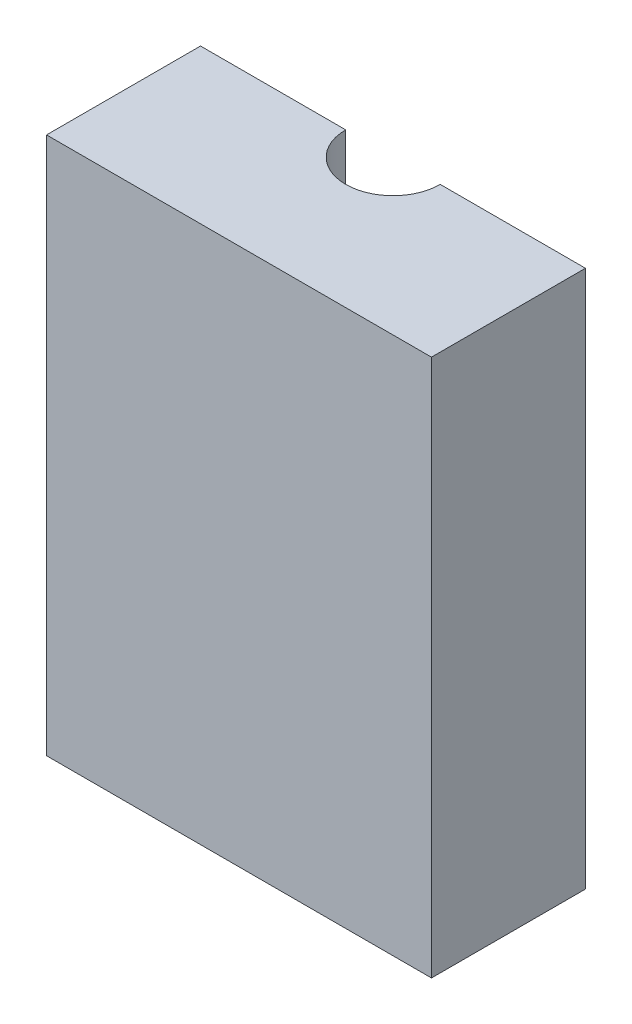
SolidWorks part; units mm, degrees
ref_plane "Front Plane" through (0, 0, 0) normal (0, 0, 1) x (1, 0, 0)
ref_plane "Top Plane" through (0, 0, 0) normal (0, 1, 0) x (1, 0, 0)
ref_plane "Right Plane" through (0, 0, 0) normal (1, 0, 0) x (0, 0, -1)
imported_body "Imported1"
sketch "Sketch1" plane through (0, 0, 0) normal (0, 0, 1) x (1, 0, 0)
  line L0 (12.2794, 66.9136) -> (-12.2794, 66.9136) construction
  line L1 (-50, -108.0864) -> (50, -108.0864)
  line L2 (-50, -108.0864) -> (-50, 66.9136)
  line L3 (-50, 66.9136) -> (50, 66.9136)
  line L4 (50, -108.0864) -> (50, 66.9136)
  line L5 (-50, -108.0864) -> (50, 66.9136) construction
  line L6 (-50, 66.9136) -> (50, -108.0864) construction
  point P0 (0, -20.5864)
  dimension "D1" = 175
  dimension "D2" = 100
extrude "Boss-Extrude1" add sketch "Sketch1" along normal mid plane 80 separate body
combine bodies "Combine3" operation type subtract main body 102 bodies to subtract 101
sketch "Sketch2" plane through (0, 66.9136, 0) normal (0, 1, 0) x (1, 0, 0)
  line L0 (-50, 0) -> (50, 0)
  line L1 (-50, -40) -> (-50, 40) construction
  line L2 (50, -40) -> (50, 40) construction
sketch "Sketch3" plane through (50, 0, 0) normal (1, 0, 0) x (0, 0, -1)
  line L0 (-40, -72.7693) -> (40, -72.7693)
  line L1 (-40, -108.0864) -> (-40, 66.9136) construction
  line L2 (-29.86, -72.7693) -> (29.86, -72.7693) construction
  line L4 (40, -108.0864) -> (40, 66.9136) construction
extrude "Cut-Extrude2" cut sketch "Sketch3" against normal through all and the other way through all flip side to cut
extrude "Cut-Extrude3" cut sketch "Sketch2" against normal through all and the other way through all
